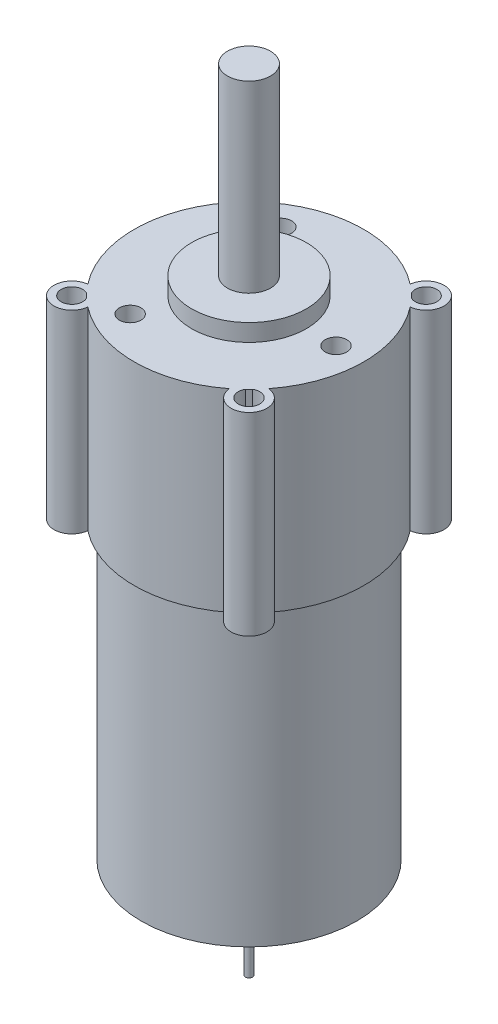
SolidWorks part; units mm, degrees
ref_plane "前视基准面" through (0, 0, 0) normal (0, 0, 1) x (1, 0, 0)
ref_plane "上视基准面" through (0, 0, 0) normal (0, 1, 0) x (1, 0, 0)
ref_plane "右视基准面" through (0, 0, 0) normal (1, 0, 0) x (0, 0, -1)
sketch "草图1" plane through (0, 0, 0) normal (0, 1, 0) x (1, 0, 0)
  line L1 (-6.0622, 10.5) -> (-6.0622, -10.5) construction
  line L2 (-6.0622, -10.5) -> (12.1244, 0) construction
  line L3 (12.1244, 0) -> (-6.0622, 10.5) construction
  circle A0 centre (0, 0) radius 16
  circle A1 centre (0, 0) radius 6.0622 construction
  circle A2 centre (-6.0622, 10.5) radius 1.5
  circle A3 centre (-6.0622, -10.5) radius 1.5
  circle A4 centre (12.1244, 0) radius 1.5
  dimension "D1" = 32
  dimension "D3" = 3
  dimension "D4" = 3
  dimension "D5" = 3
  dimension "D2" = 21
extrude "凸台-拉伸1" add sketch "草图1" along normal blind 27
sketch "草图2" plane through (0, 0, 0) normal (0, -1, 0) x (-1, 0, 0)
  circle A0 centre (0, 0) radius 15
  dimension "D1" = 30
extrude "凸台-拉伸2" add sketch "草图2" along normal blind 55
sketch "草图3" plane through (0, 27, 0) normal (0, 1, 0) x (1, 0, 0)
  line L1 (-12.339, 12.339) -> (12.339, 12.339) construction
  line L2 (-12.339, 12.339) -> (-12.339, -12.339) construction
  line L3 (-12.339, -12.339) -> (12.339, -12.339) construction
  line L4 (12.339, 12.339) -> (12.339, -12.339) construction
  line L5 (-12.339, 12.339) -> (12.339, -12.339) construction
  line L6 (-12.339, -12.339) -> (12.339, 12.339) construction
  arc A0 (11.5707, 11.0507) -> (11.0507, 11.5707) centre (12.339, 12.339) ccw
  arc A1 (11.0507, -11.5707) -> (11.5707, -11.0507) centre (12.339, -12.339) ccw
  arc A2 (-11.5707, -11.0507) -> (-11.0507, -11.5707) centre (-12.339, -12.339) ccw
  arc A3 (-11.0507, 11.5707) -> (-11.5707, 11.0507) centre (-12.339, 12.339) ccw
  arc A4 (-9.8533, 12.606) -> (-12.606, 9.8533) centre (0, 0) ccw
  arc A5 (-9.8533, 12.606) -> (-12.606, 9.8533) centre (-12.339, 12.339) ccw
  arc A6 (12.606, 9.8533) -> (9.8533, 12.606) centre (12.339, 12.339) ccw
  arc A7 (9.8533, -12.606) -> (12.606, -9.8533) centre (12.339, -12.339) ccw
  arc A8 (-12.606, -9.8533) -> (-9.8533, -12.606) centre (-12.339, -12.339) ccw
  arc A9 (12.606, 9.8533) -> (9.8533, 12.606) centre (0, 0) ccw
  arc A10 (9.8533, -12.606) -> (12.606, -9.8533) centre (0, 0) ccw
  arc A11 (-12.606, -9.8533) -> (-9.8533, -12.606) centre (0, 0) ccw
  point P0 (0, 0)
  dimension "D2" = 3
  dimension "D3" = 3
  dimension "D4" = 3
  dimension "D5" = 3
  dimension "D6" = 5
  dimension "D7" = 5
  dimension "D8" = 5
  dimension "D9" = 5
  dimension "D1" = 34.9
extrude "凸台-拉伸3" add sketch "草图3" against normal up to surface (27 mm away) contours A5 A3 M7 | A6 A0 M7 | A7 A1 M7 | A8 A2 M7
sketch "草图4" plane through (0, -55, 0) normal (0, -1, 0) x (1, 0, 0)
  circle A0 centre (0, 0) radius 15
  circle A1 centre (0, 0) radius 0.5
  dimension "D1" = 1
extrude "切除-拉伸1" cut sketch "草图4" against normal blind 14
sketch "草图5" plane through (0, 27, 0) normal (0, 1, 0) x (1, 0, 0)
  circle A0 centre (0, 0) radius 3
  dimension "D1" = 6
extrude "凸台-拉伸4" add sketch "草图5" along normal blind 28
sketch "草图6" plane through (0, 27, 0) normal (0, 1, 0) x (1, 0, 0)
  circle A0 centre (0, 0) radius 3
  circle A1 centre (0, 0) radius 8
  dimension "D1" = 16
extrude "凸台-拉伸5" add sketch "草图6" along normal blind 2.4
